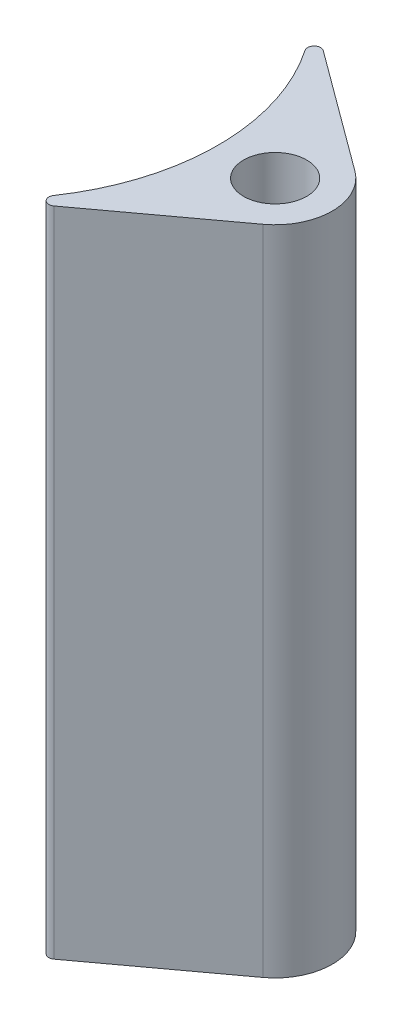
SolidWorks part; units mm, degrees
ref_plane "Front Plane" through (0, 0, 0) normal (0, 0, 1) x (1, 0, 0)
ref_plane "Top Plane" through (0, 0, 0) normal (0, 1, 0) x (1, 0, 0)
ref_plane "Right Plane" through (0, 0, 0) normal (1, 0, 0) x (0, 0, -1)
sketch "Sketch1" plane through (0, 0, 0) normal (0, 1, 0) x (1, 0, 0)
  line L0 (15.1056, -10.4833) -> (24.48, -3.579)
  line L1 (15.1056, 10.4833) -> (24.48, 3.579)
  line L2 (0, 0) -> (29.3395, 0) construction
  arc A0 (14.3844, -9.7885) -> (14.3844, 9.7885) centre (0, 0) ccw
  arc A1 (24.48, -3.579) -> (24.48, 3.579) centre (21.844, 0) ccw
  arc A2 (15.1056, -10.4833) -> (14.3844, -9.7885) centre (14.8044, -10.0743) cw
  arc A3 (15.1056, 10.4833) -> (14.3844, 9.7885) centre (14.8044, 10.0743) ccw
  circle A4 centre (21.844, 0) radius 4.445 construction
  dimension "D1" = 34.798
  dimension "D2" = 8.89
  dimension "D3" = 0.508
extrude "Boss-Extrude1" add sketch "Sketch1" along normal blind 50.8
hole_wizard "#10 (0.1935) Diameter Hole1" positions "Sketch3" profile "Sketch2" hole size "#10" standard "ANSI Inch"
sketch "Sketch3" plane through (0, 50.8, 0) normal (0, 1, 0) x (1, 0, 0)
  arc A0 (24.48, -3.579) -> (24.48, 3.579) centre (21.844, 0) ccw construction
  point P0 (21.844, 0)
sketch "Sketch2" plane through (21.844, 50.8, 0) normal (1, 0, 0) x (0, 0, 1)
  line L0 (0, 0) -> (0, 50.8)
  line L1 (0, 50.8) -> (2.4574, 50.8)
  line L2 (2.4574, 50.8) -> (2.4574, 0)
  line L5 (2.4574, 0) -> (0, 0)
  line L11 (0, -6.35) -> (0, 107.95) construction
  dimension "Thru Hole Dia." = 4.9149
  dimension "Thru Hole Depth" = 50.8
